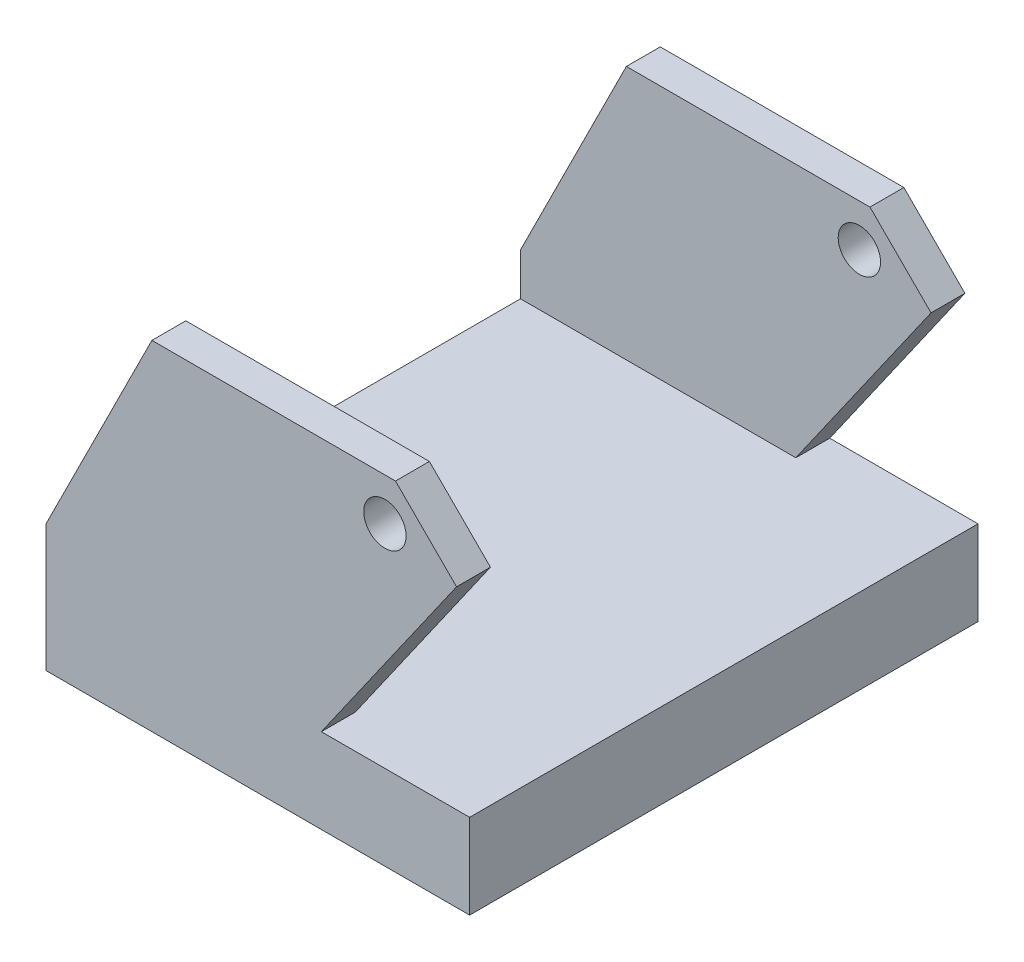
SolidWorks part; units mm, degrees
ref_plane "Front Plane" through (0, 0, 0) normal (0, 0, 1) x (1, 0, 0)
ref_plane "Top Plane" through (0, 0, 0) normal (0, 1, 0) x (1, 0, 0)
ref_plane "Right Plane" through (0, 0, 0) normal (1, 0, 0) x (0, 0, -1)
sketch "Sketch1" plane through (0, 0, 0) normal (1, 0, 0) x (0, 0, -1)
  line L0 (-60, 0) -> (60, 0)
  line L1 (60, 0) -> (60, 80)
  line L2 (60, 80) -> (52, 80)
  line L3 (52, 80) -> (52, 20)
  line L4 (52, 20) -> (-52, 20)
  line L5 (0, 0) -> (0, 90.5666) construction
  line L6 (-52, 80) -> (-52, 20)
  line L7 (-60, 80) -> (-52, 80)
  line L8 (-60, 0) -> (-60, 80)
  point P8 (0, 20)
  dimension "D1" = 60
  dimension "D2" = 8
  dimension "D3" = 20
  dimension "D4" = 80
extrude "Boss-Extrude1" add sketch "Sketch1" along normal mid plane 100
sketch "Sketch2" plane through (0, 0, 0) normal (0, 0, 1) x (1, 0, 0)
  line L0 (-25, 80) -> (-50, 30)
  line L1 (50, 80) -> (-50, 80) construction
  line L2 (-50, 80) -> (-50, 0) construction
  line L3 (-50, 30) -> (-50, 80)
  line L4 (-50, 80) -> (-25, 80)
  line L5 (46.9173, 65.5827) -> (15, 20)
  line L6 (50, 80) -> (50, 0) construction
  line L7 (15, 20) -> (50, 20)
  line L8 (50, 69.9852) -> (50, 20)
  line L9 (46.9173, 65.5827) -> (32.5, 80)
  line L10 (32.5, 80) -> (50, 80)
  line L11 (50, 80) -> (50, 69.9852)
  circle A0 centre (30, 70) radius 5
  dimension "D5" = 10
  dimension "D1" = 50
  dimension "D2" = 25
  dimension "D3" = 35
  dimension "D4" = 55
  dimension "D6" = 20
  dimension "D7" = 10
  dimension "D8" = 45
extrude "Cut-Extrude1" cut sketch "Sketch2" against normal through all both and the other way through all
